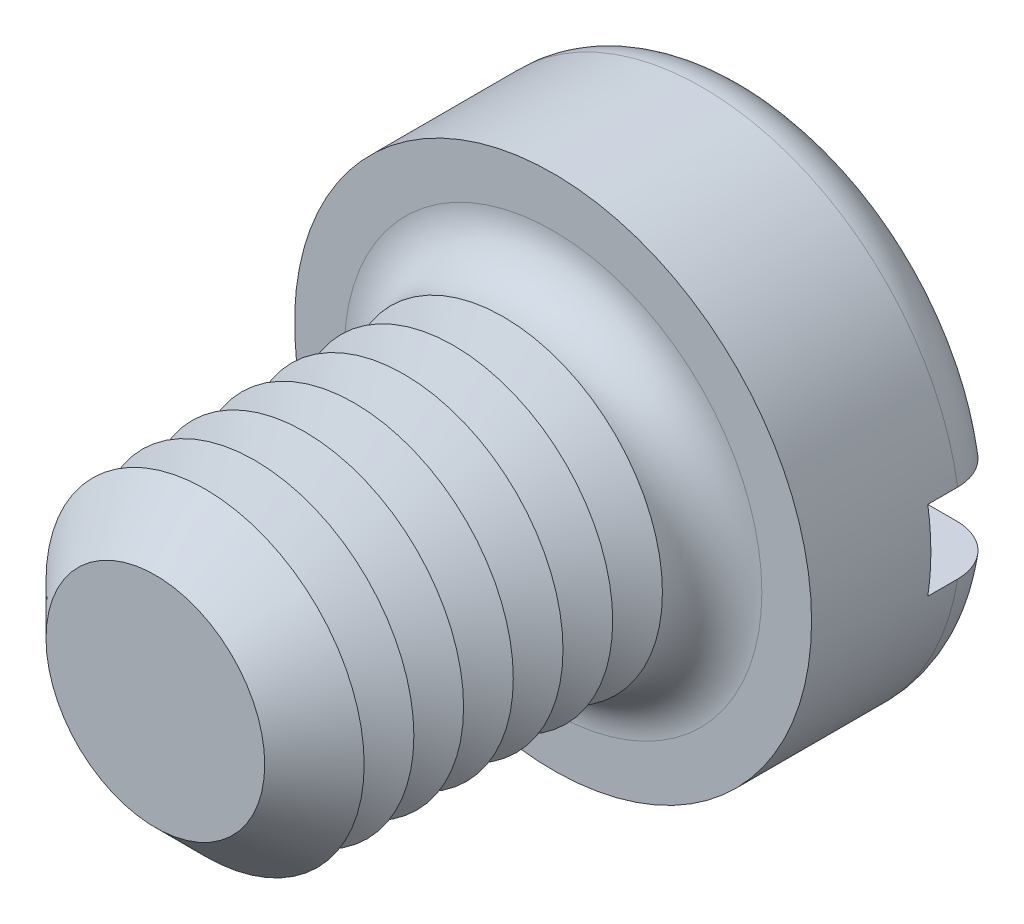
SolidWorks part; units mm, degrees
ref_plane "Front Plane" through (0, 0, 0) normal (0, 0, 1) x (1, 0, 0)
ref_plane "Top Plane" through (0, 0, 0) normal (0, 1, 0) x (1, 0, 0)
ref_plane "Right Plane" through (0, 0, 0) normal (1, 0, 0) x (0, 0, -1)
sketch "Sketch3" plane through (0, 0, 0) normal (0, 0, 1) x (1, 0, 0)
  circle A0 centre (0, 0) radius 6.5
  dimension "D1" = 13
extrude "Boss-Extrude2" add sketch "Sketch3" against normal blind 5
sketch "Sketch4" plane through (0, 0, 0) normal (0, 0, 1) x (1, 0, 0)
  circle A0 centre (0, 0) radius 4
  dimension "D1" = 8
extrude "Boss-Extrude3" add sketch "Sketch4" along normal blind 10
fillet "Fillet1" radius 1.25 2 edges at (6.5, 0, -5) (4, 0, 0)
chamfer "Chamfer1" distance 1.25 angle 45 1 edges at (4, 0, 10)
sketch "Sketch5" plane through (0, 0, 0) normal (1, 0, 0) x (0, 0, -1)
  line L0 (1.6944, 0) -> (-7.6738, 0) construction
sketch "Sketch6" plane through (0, 0, 0) normal (1, 0, 0) x (0, 0, -1)
  line L0 (-1.25, 4) -> (-1.875, 2.9175)
  line L1 (-1.875, 2.9175) -> (-2.5, 4)
  line L2 (-1.25, 4) -> (-8.75, 4) construction
  line L3 (-2.5, 4) -> (-1.25, 4)
  dimension "D1" = 1.25
revolve "Cut-Revolve1" cut sketch "Sketch6" angle 360 about L0
pattern_linear "LPattern1" count 6 spacing 1.25 along (0, 0, 1) of "Cut-Revolve1"
sketch "Sketch8" plane through (0, 0, -5) normal (0, 0, -1) x (-1, 0, 0)
  line L1 (6.5, -1) -> (-6.5, -1)
  line L2 (6.5, -1) -> (6.5, 1)
  line L3 (6.5, 1) -> (-6.5, 1)
  line L4 (-6.5, -1) -> (-6.5, 1)
  line L5 (6.5, -1) -> (-6.5, 1) construction
  line L6 (6.5, 1) -> (-6.5, -1) construction
  point P0 (0, 0)
  dimension "D1" = 13
  dimension "D2" = 2
extrude "Cut-Extrude1" cut sketch "Sketch8" against normal blind 2
